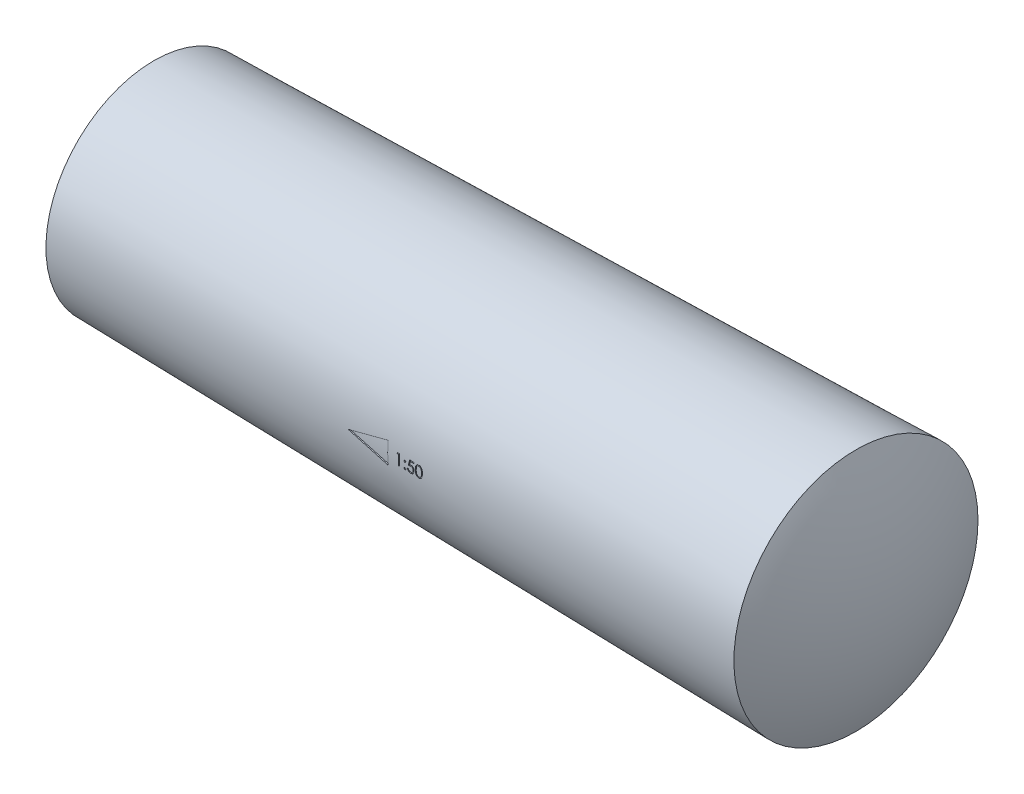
SolidWorks part; units mm, degrees
ref_plane "Front Plane" through (0, 0, 0) normal (0, 0, 1) x (1, 0, 0)
ref_plane "Top Plane" through (0, 0, 0) normal (0, 1, 0) x (1, 0, 0)
ref_plane "Right Plane" through (0, 0, 0) normal (1, 0, 0) x (0, 0, -1)
sketch "Sketch1" plane through (0, 0, 0) normal (1, 0, 0) x (0, 0, -1)
  circle A0 centre (0, 0) radius 10
  dimension "D1" = 20
extrude "Extrude1" add sketch "Sketch1" along normal mid plane 65
draft "Draft1" type of draft neutral plane draft angle 1.146 faces to draft 1 parameters "D1"=1.146
sketch "Sketch2" plane through (0, 0, 0) normal (0, 0, 1) x (1, 0, 0)
  line L0 (-32.5, 0) -> (-32.5, 10)
  line L1 (-32.5, 10) -> (-32.5, -10) construction
  line L2 (-32.5, 0) -> (-35, 0)
  line L3 (-35, 0) -> (-35, -10.65) construction
  line L4 (32.5, 0) -> (32.5, 11.3)
  line L5 (32.5, -11.3) -> (32.5, 11.3) construction
  line L6 (32.5, 0) -> (35, 0)
  line L7 (35, 0) -> (35, -10.65) construction
  line L8 (-32.5, -10) -> (32.5, -11.3) construction
  arc A0 (-35, 0) -> (-32.5, 10) centre (-13.75, 0) cw
  arc A1 (35, 0) -> (32.5, 11.3) centre (8.2118, 0) ccw
  point P14 (0, -10.65)
revolve "Revolve1" add sketch "Sketch2" angle 360 about L2
sketch "Sketch5" plane through (0, 0, 0) normal (0, 0, 1) x (1, 0, 0)
  line L0 (0, 10.65) -> (0, -10.65) construction
  line L1 (32.5, 11.3) -> (-32.5, 10) construction
  line L2 (-32.5, -10) -> (32.5, -11.3) construction
ref_plane "Plane2" through (0, 0, 0) normal (-0.02, 0, 0.9998) x (0.9998, 0, 0.02)
sketch "Sketch6" plane through (0, 0, 0) normal (-0.02, 0, 0.9998) x (0.9998, 0, 0.02)
  line L0 (0, 0) -> (0, 1)
  line L1 (0, 10.65) -> (0, -10.65) construction
  line L2 (0, 1) -> (-3.7321, 0)
  line L3 (-3.7321, 0) -> (0, -1)
  line L4 (0, -1) -> (0, 0)
  line L5 (0, -0.5) -> (4, -0.5) construction
  text T0 "1:50" font "Century Gothic" height 1
  dimension "D1" = 2
  dimension "D2" = 30
  dimension "D3" = 4
wrap "Wrap2" sketch "Sketch6" wrap type deboss source sketch "Sketch6" thickness 0.1 parameters "D1"=0.1
equation "\"D2@Sketch2\" = \"D1@Sketch2\""
